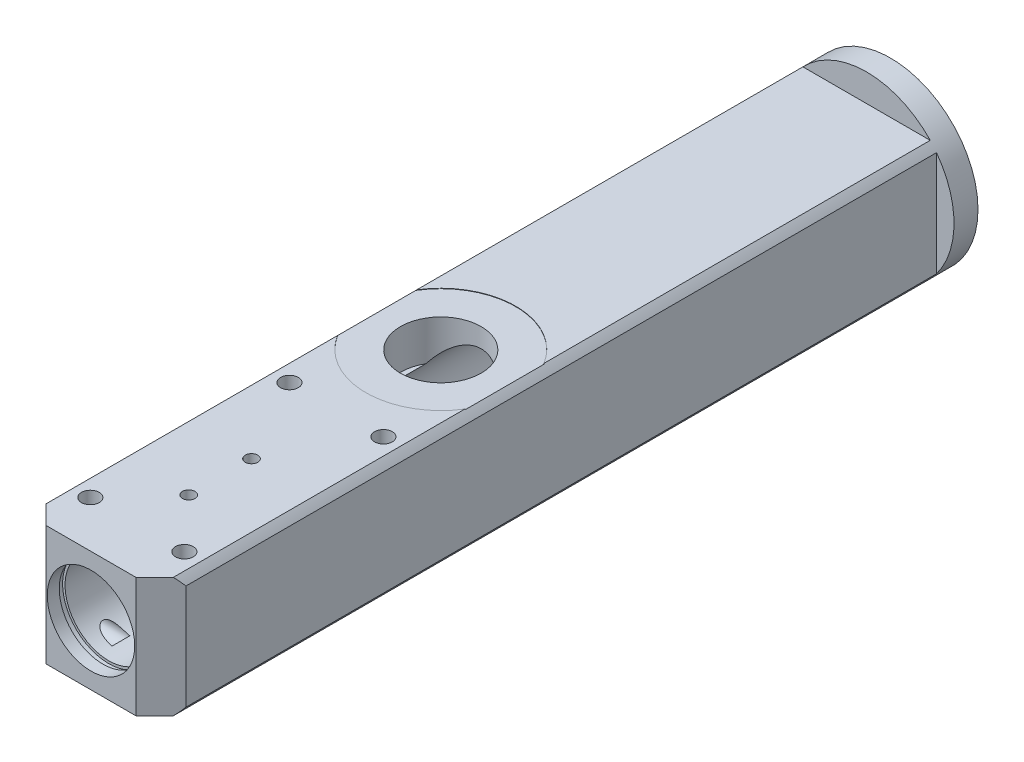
SolidWorks part; units mm, degrees
ref_plane "Front Plane" through (0, 0, 0) normal (0, 0, 1) x (1, 0, 0)
ref_plane "Top Plane" through (0, 0, 0) normal (0, 1, 0) x (1, 0, 0)
ref_plane "Right Plane" through (0, 0, 0) normal (1, 0, 0) x (0, 0, -1)
sketch "Sketch1" plane through (0, 0, 0) normal (0, 0, 1) x (1, 0, 0)
  circle A0 centre (0, 0) radius 11.1125
  dimension "D1" = 22.225
extrude "stem" add sketch "Sketch1" along normal blind 101.6
ref_plane "LLE_plane" through (0, 7.62, 0) normal (0, 1, 0) x (-1, 0, 0)
ref_plane "seat_top_plane" through (0, 0, 3.048) normal (0, 0, -1) x (-1, 0, 0)
sketch "Sketch3" plane through (0, 7.62, 0) normal (0, 1, 0) x (-1, 0, 0)
  line L0 (0, 0) -> (0, 13.97) construction
  line L1 (0, 13.97) -> (0, 69.85) construction
  line L2 (0, 69.85) -> (13.4689, 69.85)
  line L3 (13.4689, 69.85) -> (13.4689, 3.048)
  line L4 (13.4689, 3.048) -> (-13.5552, 3.048)
  line L5 (-13.5552, 3.048) -> (-13.5552, 69.85)
  line L6 (-13.5552, 69.85) -> (0, 69.85)
  line L7 (-11.1125, 0) -> (11.1125, 0) construction
  dimension "D1" = 3.048
  dimension "D2" = 13.97
  dimension "D3" = 69.85
extrude "hex_land" cut sketch "Sketch3" along normal blind 5.08
sketch "Sketch5" plane through (0, 0, 0) normal (0, 0, -1) x (-1, 0, 0)
  circle A0 centre (0, 0) radius 5.1308
  dimension "D1" = 10.2616
extrude "pump_port" cut sketch "Sketch5" against normal blind 63.5
sketch "Sketch4" plane through (0, 7.62, 0) normal (0, 1, 0) x (-1, 0, 0)
  line L0 (-5.1308, 63.5) -> (5.1308, 63.5) construction
  circle A0 centre (0, 57.15) radius 5.1308
  dimension "D1" = 10.2616
  dimension "D3" = 6.35
extrude "M12-1_thru" cut sketch "Sketch4" against normal blind 5.08
sketch "Sketch24" plane through (0, 7.62, 0) normal (0, 1, 0) x (1, 0, 0)
  circle A0 centre (0, -57.15) radius 9.525
  dimension "D1" = 19.05
extrude "M12_land" cut sketch "Sketch24" against normal blind 0.0508
sketch "Sketch14" plane through (0, 0, 63.5) normal (0, 0, -1) x (-1, 0, 0)
  circle A0 centre (0, 0) radius 2.3813
  dimension "D1" = 4.7625
extrude "pump_valve_port" cut sketch "Sketch14" against normal blind 18.796
sketch "Sketch6" plane through (0, 7.62, 0) normal (0, 1, 0) x (-1, 0, 0)
  line L0 (0, 68.58) -> (0, 99.06) construction
  line L1 (-10.16, 99.06) -> (10.16, 99.06)
  line L2 (10.16, 99.06) -> (10.16, 68.58)
  line L3 (10.16, 68.58) -> (-10.16, 68.58)
  line L4 (-10.16, 99.06) -> (-10.16, 68.58)
  line L5 (11.1125, 101.6) -> (-11.1125, 101.6) construction
  dimension "D1" = 10.16
  dimension "D2" = 30.48
  dimension "D3" = 2.54
extrude "valve_land" cut sketch "Sketch6" along normal blind 25.4
sketch "Sketch7" plane through (0, 7.62, 0) normal (0, 1, 0) x (1, 0, 0)
  line L0 (0, -99.06) -> (0, -85.1916) construction
  line L1 (8.0885, -99.06) -> (-8.0885, -99.06) construction
  line L2 (0, -85.1916) -> (-4.6697, -85.1916) construction
  circle A0 centre (0, -89.1794) radius 0.7937
  circle A1 centre (0, -81.2038) radius 0.7937
  dimension "D2" = 1.5875
  dimension "D3" = 3.9878
  dimension "D1" = 13.8684
extrude "valve_ports" cut sketch "Sketch7" against normal blind 6.35
sketch "Sketch9" plane through (0, 0, 101.6) normal (0, 0, 1) x (1, 0, 0)
  circle A0 centre (0, 0) radius 5.5562
  dimension "D1" = 11.1125
extrude "vent_cbore" cut sketch "Sketch9" against normal blind 9.144
ref_plane "ring_plane" through (0, 0, 100.076) normal (0, 0, 1) x (1, 0, 0)
sketch "Sketch13" plane through (0, 0, 100.076) normal (0, 0, 1) x (1, 0, 0)
  circle A0 centre (0, 0) radius 5.8674
  dimension "D1" = 11.7348
extrude "ring_groove" cut sketch "Sketch13" against normal blind 0.7366
sketch "Sketch15" plane through (0, 0, 92.456) normal (0, 0, 1) x (1, 0, 0)
  circle A0 centre (0, 0) radius 2.3813
  dimension "D1" = 4.7625
extrude "vent_port" cut sketch "Sketch15" against normal blind 4.064
sketch "Sketch16" plane through (0, 7.62, 0) normal (0, 1, 0) x (1, 0, 0)
  line L0 (0, -89.1794) -> (0, -83.058) construction
  line L1 (0, -83.058) -> (-5.969, -83.058) construction
  line L2 (-5.969, -83.058) -> (-5.969, -95.7072) construction
  circle A0 centre (-5.969, -95.7072) radius 1.1303
  circle A1 centre (-5.969, -70.4088) radius 1.1303
  circle A2 centre (5.969, -95.7072) radius 1.1303
  circle A3 centre (5.969, -70.4088) radius 1.1303
  dimension "D4" = 2.2606
  dimension "D1" = 6.1214
  dimension "D2" = 5.969
  dimension "D3" = 12.6492
extrude "valve_mount_holes" cut sketch "Sketch16" against normal blind 6.35
ref_plane "back_plane" through (0, -7.62, 0) normal (0, 1, 0) x (-1, 0, 0)
sketch "Sketch17" plane through (0, -7.62, 0) normal (0, 1, 0) x (-1, 0, 0)
  line L0 (-12.2237, 3.048) -> (12.2237, 3.048) construction
  line L1 (-11.1125, 3.048) -> (11.1125, 3.048)
  line L2 (-11.1125, 3.048) -> (-11.1125, 101.6)
  line L3 (-11.1125, 101.6) -> (11.1125, 101.6)
  line L4 (11.1125, 3.048) -> (11.1125, 101.6)
  line L5 (-11.1125, 101.6) -> (-11.1125, 0) construction
extrude "back_cut" cut sketch "Sketch17" against normal blind 12.7
sketch "Sketch18" plane through (0, 0, 3.048) normal (0, 0, -1) x (-1, 0, 0)
  line L0 (0, 0) -> (-8.89, 0) construction
  line L1 (-8.89, -12.7) -> (-8.89, 12.7)
  line L2 (0, 0) -> (0, -12.5191) construction
  line L3 (8.89, -12.7) -> (8.89, 12.7)
  line L4 (8.89, 12.7) -> (-8.89, 12.7)
  line L5 (8.89, -12.7) -> (-8.89, -12.7)
  dimension "D1" = 8.89
  dimension "D2" = 25.4
extrude "side_cuts" cut sketch "Sketch18" against normal blind 101.6 flip side to cut
sketch "Sketch19" plane through (0, 7.62, 0) normal (0, 1, 0) x (1, 0, 0)
  line L0 (8.0885, -101.6) -> (8.89, -101.6) construction
  line L1 (11.149, -87.376) -> (-11.5206, -87.376)
  line L2 (11.149, -87.376) -> (11.149, -104.14)
  line L3 (11.149, -104.14) -> (-11.5206, -104.14)
  line L4 (-11.5206, -87.376) -> (-11.5206, -104.14)
  line L6 (-12.2237, -100.076) -> (12.2237, -100.076) construction
  dimension "D1" = 2.54
  dimension "D2" = 12.7
extrude "vacuum_cut" cut sketch "Sketch19" along normal blind 12.7
sketch "Sketch20" plane through (0, 0, 0) normal (0, 0, -1) x (-1, 0, 0)
  circle A0 centre (0, 0) radius 5.1308
  circle A1 centre (0, 0) radius 6.3246
  dimension "D1" = 12.6492
  dimension "D2" = 10.2616
extrude "seat_extension" add sketch "Sketch20" along normal blind 2.54
chamfer "seat_chamfer" distance 0.762 angle 30 1 edges at (-6.3246, 0, -2.54)
sketch "Sketch21" plane through (0, 0, 0) normal (0, 0, -1) x (-1, 0, 0)
  circle A0 centre (0, 0) radius 6.3246
  circle A1 centre (0, 0) radius 8.89
  dimension "D1" = 12.6492
  dimension "D2" = 17.78
extrude "seat_oring_groove" cut sketch "Sketch21" against normal blind 1.27
sketch "Sketch22" plane through (0, 0, 0) normal (0, 0, -1) x (-1, 0, 0)
  circle A0 centre (0, 0) radius 9.525
  dimension "D1" = 19.05
chamfer "Chamfer1" distance 3.175 angle 45 2 edges at (-8.89, 0, 101.6) (8.89, 0, 101.6)
sketch "Sketch23" plane through (-8.89, 0, 0) normal (-1, 0, 0) x (0, 0, 1)
  line L0 (3.048, -6.6675) -> (98.425, -6.6675) construction
  line L1 (101.6, 7.62) -> (101.6, -7.62) construction
  circle A0 centre (96.52, -5.3975) radius 1.1303
  circle A1 centre (71.12, -5.3975) radius 1.1303
  dimension "D1" = 2.2606
  dimension "D2" = 2.2606
  dimension "D3" = 1.27
  dimension "D4" = 1.27
  dimension "D5" = 5.08
  dimension "D6" = 25.4
extrude "pcb_mount" cut sketch "Sketch23" against normal blind 7.62
